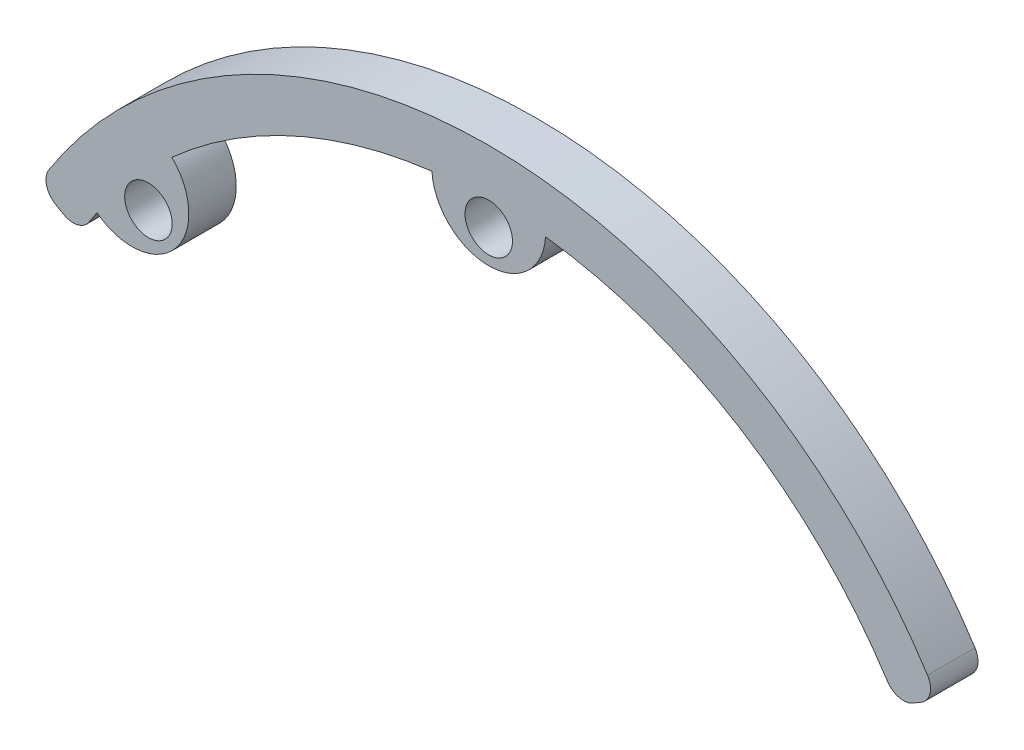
SolidWorks part; units mm, degrees
ref_plane "前视基准面" through (0, 0, 0) normal (0, 0, 1) x (1, 0, 0)
ref_plane "上视基准面" through (0, 0, 0) normal (0, 1, 0) x (1, 0, 0)
ref_plane "右视基准面" through (0, 0, 0) normal (1, 0, 0) x (0, 0, -1)
other "Configuration Table"
sketch "草图1" plane through (0, 0, 0) normal (0, 0, 1) x (1, 0, 0)
  line L0 (-47.4365, 27.8348) -> (-43.1241, 25.3044)
  line L1 (47.3425, 27.9943) -> (43.0387, 25.4494)
  line L2 (-82.2177, 35.9892) -> (79.1459, 37.3109) construction
  line L3 (0, 107.8709) -> (0, -14.1586) construction
  arc A0 (-47.4365, 27.8348) -> (47.3425, 27.9943) centre (0, 0) cw
  arc A1 (-43.1241, 25.3044) -> (43.0387, 25.4494) centre (0, 0) cw
  arc A2 (-5.9892, 49.64) -> (5.9892, 49.64) centre (0, 50) ccw
  arc A3 (-41.2876, 28.2017) -> (-33.3952, 37.2123) centre (-37.6122, 32.9442) ccw
  circle A4 centre (-35.869, 31.1395) radius 2.5
  circle A5 centre (0, 47.5) radius 2.5
  dimension "D2" = 6
  dimension "D3" = 6
  dimension "D4" = 55
  dimension "D5" = 50
  dimension "D6" = 5
  dimension "D7" = 5
  dimension "D1" = 119
  dimension "D8" = 47.5
extrude "凸台-拉伸1" add sketch "草图1" along normal blind 5 contours L0 A1 L1 A0 | A1 A5 A2 | A1 A4 A3
fillet "圆角6" radius 2 1 edges at (-43.1241, 25.3044, 2.5)
fillet "圆角5" radius 2 1 edges at (43.0387, 25.4494, 2.5)
fillet "圆角7" radius 2 2 edges at (47.3425, 27.9943, 2.5) (-47.4365, 27.8348, 2.5)
